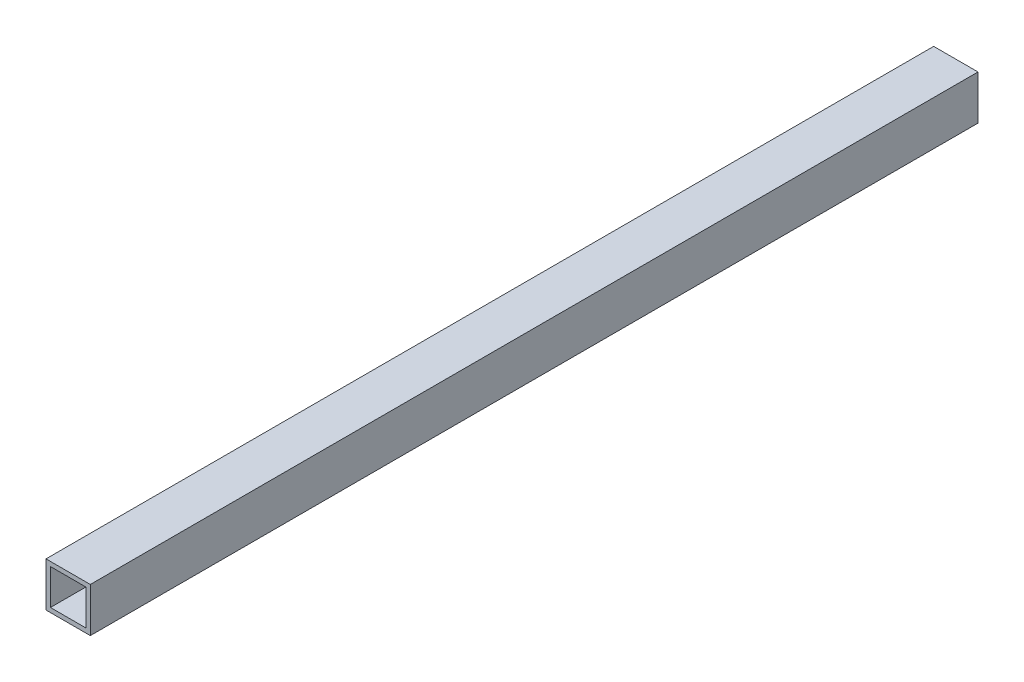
SolidWorks part; units mm, degrees
ref_plane "Plan de face" through (0, 0, 0) normal (0, 0, 1) x (1, 0, 0)
ref_plane "Plan de dessus" through (0, 0, 0) normal (0, 1, 0) x (1, 0, 0)
ref_plane "Plan de droite" through (0, 0, 0) normal (1, 0, 0) x (0, 0, -1)
sketch "Esquisse1" plane through (0, 0, 0) normal (0, 0, 1) x (1, 0, 0)
  line L0 (-4.9194, 6.2171) -> (5.0806, -3.7829) construction
  line L1 (-4.9194, 6.2171) -> (5.0806, 6.2171)
  line L2 (-4.9194, 6.2171) -> (-4.9194, -3.7829)
  line L3 (-4.9194, -3.7829) -> (5.0806, -3.7829)
  line L4 (5.0806, 6.2171) -> (5.0806, -3.7829)
  line L5 (5.0806, 6.2171) -> (-4.9194, -3.7829) construction
  line L7 (4.0806, -2.7829) -> (-3.9194, -2.7829)
  line L8 (4.0806, -2.7829) -> (4.0806, 5.2171)
  line L9 (4.0806, 5.2171) -> (-3.9194, 5.2171)
  line L10 (-3.9194, -2.7829) -> (-3.9194, 5.2171)
  line L11 (4.0806, -2.7829) -> (-3.9194, 5.2171) construction
  line L12 (4.0806, 5.2171) -> (-3.9194, -2.7829) construction
  point P4 (0.0806, 1.2171)
  dimension "D1" = 10
  dimension "D2" = 1
extrude "Boss.-Extru.2" add sketch "Esquisse1" along normal blind 200.25
